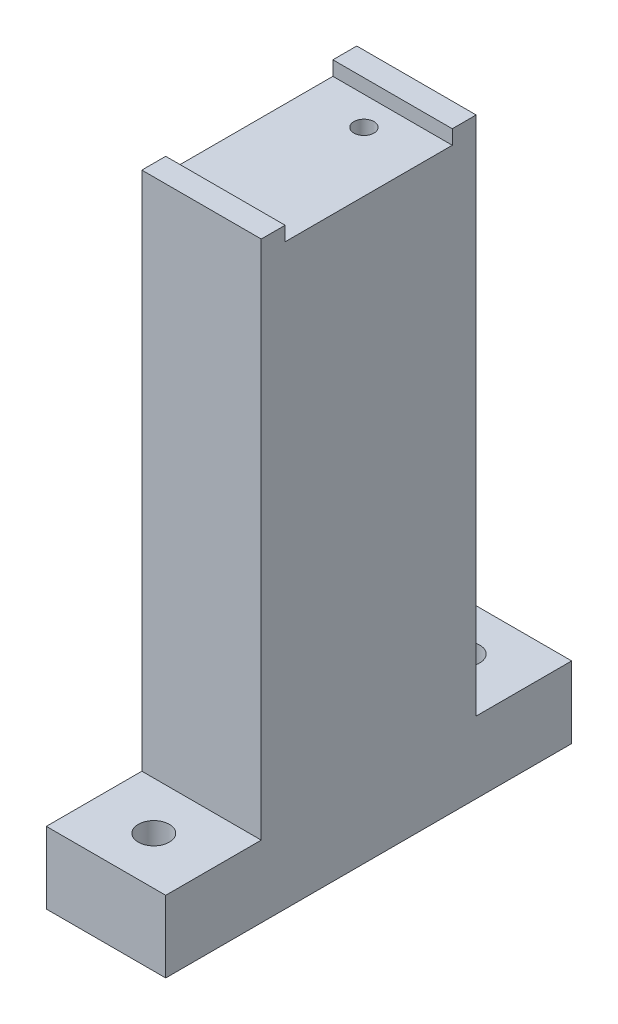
SolidWorks part; units mm, degrees
ref_plane "前视基准面" through (0, 0, 0) normal (0, 0, 1) x (1, 0, 0)
ref_plane "上视基准面" through (0, 0, 0) normal (0, 1, 0) x (1, 0, 0)
ref_plane "右视基准面" through (0, 0, 0) normal (1, 0, 0) x (0, 0, -1)
sketch "草图1" plane through (0, 0, 0) normal (0, 0, 1) x (1, 0, 0)
  line L0 (0, 0) -> (0, 124)
  line L1 (25, 0) -> (25, 124)
  line L2 (0, 124) -> (25, 124)
  line L3 (0, 0) -> (25, 0)
extrude "凸台-拉伸1" add sketch "草图1" along normal blind 85
sketch "草图2" plane through (25, 0, 0) normal (1, 0, 0) x (0, 0, -1)
  line L0 (-60, 121) -> (-25, 121)
  line L1 (-65, 124) -> (-60, 124)
  line L2 (-85, 15) -> (-65, 15)
  line L3 (-85, 0) -> (0, 0)
  line L4 (-65, 15) -> (-65, 124)
  line L5 (-20, 15) -> (-20, 124)
  line L6 (-85, 0) -> (-85, 15)
  line L7 (0, 0) -> (0, 15)
  line L8 (-25, 124) -> (-20, 124)
  line L9 (-60, 121) -> (-60, 124)
  line L10 (-25, 121) -> (-25, 124)
  line L11 (-20, 15) -> (0, 15)
extrude "切除-拉伸1" cut sketch "草图2" against normal blind 85 flip side to cut
sketch "草图3" plane through (0, 121, 0) normal (0, 1, 0) x (1, 0, 0)
  circle A0 centre (12.5, -10) radius 3.25
  circle A1 centre (12.5, -75) radius 3.25
extrude "切除-拉伸2" cut sketch "草图3" against normal through all
sketch "草图4" plane through (0, 121, 0) normal (0, 1, 0) x (1, 0, 0)
  circle A0 centre (12.5, -31) radius 2.1
extrude "切除-拉伸3" cut sketch "草图4" against normal blind 15
